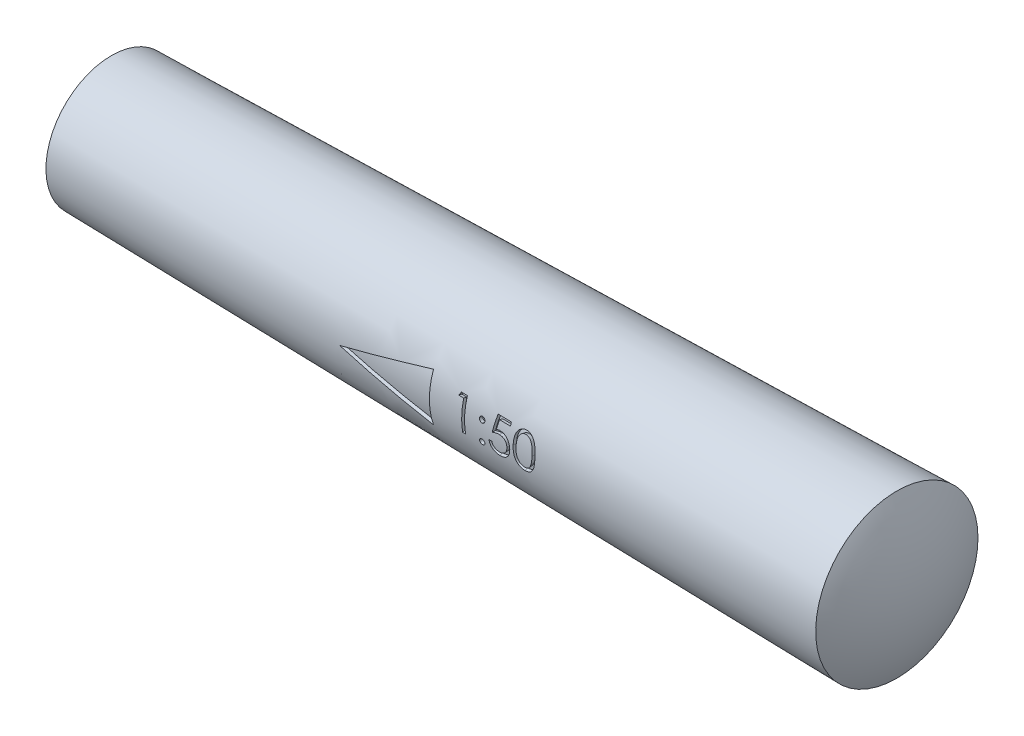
SolidWorks part; units mm, degrees
ref_plane "Front Plane" through (0, 0, 0) normal (0, 0, 1) x (1, 0, 0)
ref_plane "Top Plane" through (0, 0, 0) normal (0, 1, 0) x (1, 0, 0)
ref_plane "Right Plane" through (0, 0, 0) normal (1, 0, 0) x (0, 0, -1)
sketch "Sketch1" plane through (0, 0, 0) normal (1, 0, 0) x (0, 0, -1)
  circle A0 centre (0, 0) radius 2
  dimension "D1" = 4
extrude "Extrude1" add sketch "Sketch1" along normal mid plane 24
draft "Draft1" type of draft neutral plane draft angle 1.146 faces to draft 1 parameters "D1"=1.146
sketch "Sketch2" plane through (0, 0, 0) normal (0, 0, 1) x (1, 0, 0)
  line L0 (-12, 0) -> (-12, 2)
  line L1 (-12, 2) -> (-12, -2) construction
  line L2 (-12, 0) -> (-12.6, 0)
  line L3 (-12.6, 0) -> (-12.6, -2.24) construction
  line L4 (12, 0) -> (12, 2.48)
  line L5 (12, -2.48) -> (12, 2.48) construction
  line L6 (12, 0) -> (12.6, 0)
  line L7 (12.6, 0) -> (12.6, -2.24) construction
  line L8 (-12, -2) -> (12, -2.48) construction
  arc A0 (-12.6, 0) -> (-12, 2) centre (-8.9667, 0) cw
  arc A1 (12.6, 0) -> (12, 2.48) centre (7.1746, 0) ccw
  point P14 (0, -2.24)
revolve "Revolve1" add sketch "Sketch2" angle 360 about L2
sketch "Sketch5" plane through (0, 0, 0) normal (0, 0, 1) x (1, 0, 0)
  line L0 (0, 2.24) -> (0, -2.24) construction
  line L1 (12, 2.48) -> (-12, 2) construction
  line L2 (-12, -2) -> (12, -2.48) construction
ref_plane "Plane2" through (0, 0, 0) normal (-0.02, 0, 0.9998) x (0.9998, 0, 0.02)
sketch "Sketch6" plane through (0, 0, 0) normal (-0.02, 0, 0.9998) x (0.9998, 0, 0.02)
  line L0 (0, 0) -> (0, 0.75)
  line L1 (0, 2.24) -> (0, -2.24) construction
  line L2 (0, 0.75) -> (-2.799, 0)
  line L3 (-2.799, 0) -> (0, -0.75)
  line L4 (0, -0.75) -> (0, 0)
  line L5 (0, -0.375) -> (4, -0.375) construction
  text T0 "1:50" font "Century Gothic" height 1
  dimension "D1" = 1.5
  dimension "D2" = 30
  dimension "D3" = 4
wrap "Wrap2" sketch "Sketch6" wrap type deboss source sketch "Sketch6" thickness 0.1 parameters "D1"=0.1
equation "\"D2@Sketch2\" = \"D1@Sketch2\""
